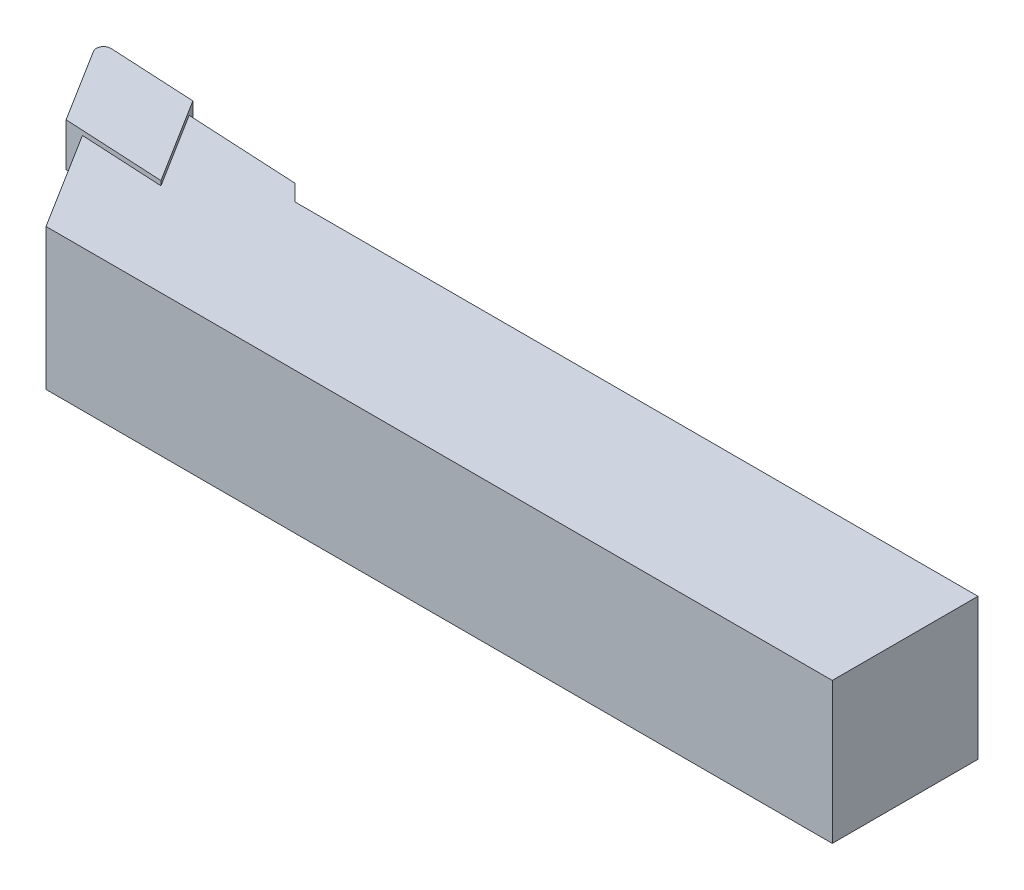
SolidWorks part; units mm, degrees
ref_plane "Plan1" through (0, 0, 0) normal (0, 0, 1) x (1, 0, 0)
ref_plane "Plan2" through (0, 0, 0) normal (0, 1, 0) x (1, 0, 0)
ref_plane "Plan3" through (0, 0, 0) normal (1, 0, 0) x (0, 0, -1)
sketch "EsqPlaquette" plane through (0, 0, 0) normal (0, 1, 0) x (1, 0, 0)
  line L0 (0.1216, -1.2239) -> (5.1363, -9.2492)
  line L1 (0.8419, -0.0011) -> (10.2921, -0.4964)
  line L2 (0, 0) -> (0, -30) construction
  line L3 (10.2921, -0.4964) -> (16.1212, -9.8249)
  line L4 (5.1363, -9.2492) -> (16.1212, -9.8249)
  line L5 (0, 0) -> (50, 0) construction
  arc A0 (0.8419, -0.0011) -> (0.1216, -1.2239) centre (0.8, -0.8) ccw
  dimension "RBec" = 0.8
  dimension "D1" = 55
  dimension "D3" = 125
  dimension "D4" = 32
  dimension "D5" = 11
  dimension "D6" = 11
  dimension "D7" = 125
extrude "Base-Extrusion" add sketch "EsqPlaquette" against normal blind 4.76
ref_plane "Plan4" through (0, -0.5, 0) normal (0, 1, 0) x (-1, 0, 0)
sketch "Esquisse2" plane through (0, -0.5, 0) normal (0, 1, 0) x (-1, 0, 0)
  line L0 (0, 0) -> (-28, 0) construction
  line L1 (-100, 4) -> (-100, 20)
  line L3 (-100, 20) -> (-13.6766, 20)
  line L4 (-100, 4) -> (-25, 4)
  line L5 (-1.866, 1.0992) -> (-23.2182, 2.2182)
  line L6 (-1.866, 1.0992) -> (-13.6766, 20)
  line L8 (-25, 4) -> (-23.2182, 2.2182)
  dimension "D1" = 1
  dimension "D2" = 1
  dimension "D3" = 55
  dimension "D4" = 3
  dimension "D5" = 20
  dimension "D6" = 16
  dimension "D7" = 25
  dimension "D8" = 100
  dimension "D10" = 135
extrude "Boss.-Extru.1" add sketch "Esquisse2" against normal blind 15.5
